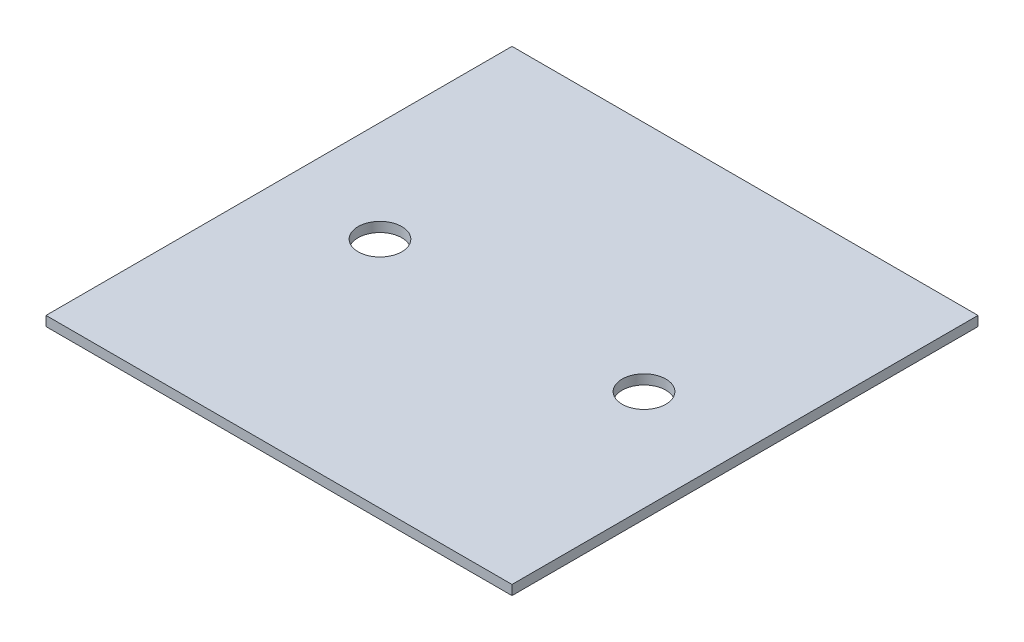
SolidWorks part; units mm, degrees
ref_plane "Front Plane" through (0, 0, 0) normal (0, 0, 1) x (1, 0, 0)
ref_plane "Top Plane" through (0, 0, 0) normal (0, 1, 0) x (1, 0, 0)
ref_plane "Right Plane" through (0, 0, 0) normal (1, 0, 0) x (0, 0, -1)
sketch "Sketch1" plane through (0, 0, 0) normal (0, 1, 0) x (1, 0, 0)
  line L1 (-76.2, 76.2) -> (76.2, 76.2)
  line L2 (-76.2, 76.2) -> (-76.2, -76.2)
  line L3 (-76.2, -76.2) -> (76.2, -76.2)
  line L4 (76.2, 76.2) -> (76.2, -76.2)
  point P4 (0, 76.2)
  point P6 (-76.2, 0)
  dimension "D1" = 152.4
  dimension "D2" = 152.4
extrude "Boss-Extrude1" add sketch "Sketch1" along normal blind 3.175
sketch "Sketch2" plane through (0, 0, 0) normal (0, 1, 0) x (1, 0, 0)
  circle A0 centre (-43.18, 0) radius 7.1437
  circle A1 centre (43.18, 0) radius 7.1437
  dimension "D3" = 14.2875
  dimension "D4" = 14.2875
  dimension "D1" = 43.18
  dimension "D2" = 43.18
extrude "Cut-Extrude1" cut sketch "Sketch2" along normal blind 25.4
